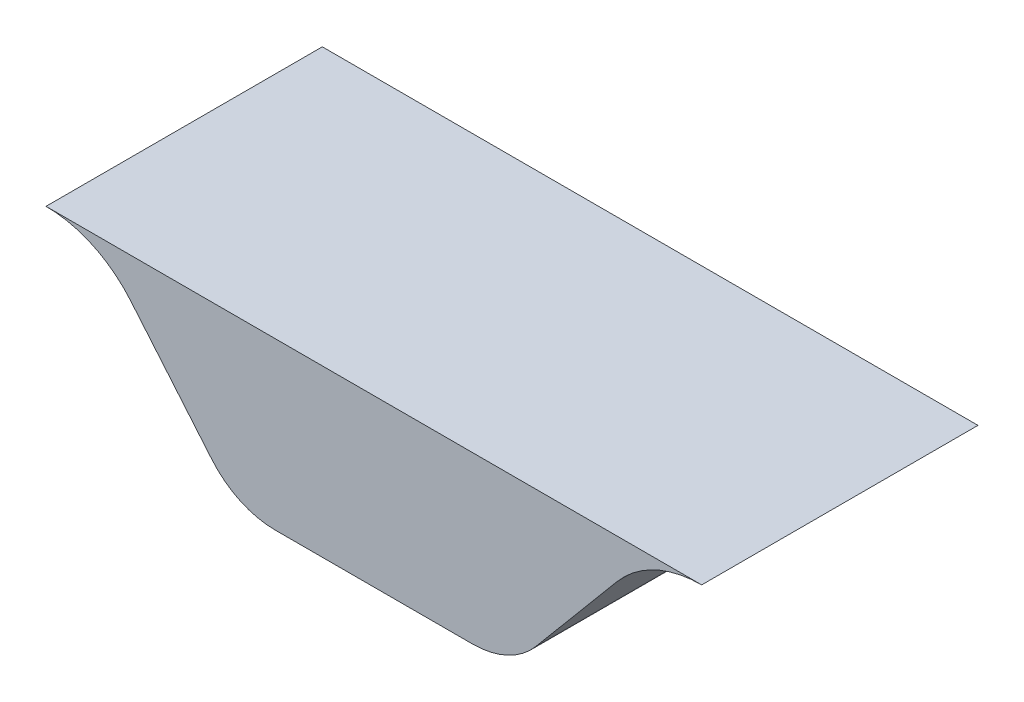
SolidWorks part; units mm, degrees
ref_plane "Plane1" through (0, 0, 0) normal (0, 0, 1) x (1, 0, 0)
ref_plane "Plane2" through (0, 0, 0) normal (0, 1, 0) x (1, 0, 0)
ref_plane "Plane3" through (0, 0, 0) normal (1, 0, 0) x (0, 0, -1)
sketch "Sketch1" plane through (0, 0, 0) normal (0, 0, 1) x (1, 0, 0)
  line L0 (-25, 5) -> (25, 5)
  line L1 (-25, 5) -> (-25, 0)
  line L2 (25, 0) -> (-25, 0)
  line L3 (25, 0) -> (25, 5)
  line L4 (0, 5) -> (0, 0) construction
  line L5 (50, 0) -> (-50, 0) construction
  dimension "D1" = 50
  dimension "D2" = 5
extrude "Base-Extrude" add sketch "Sketch1" along normal mid plane 50
sketch "Sketch2" plane through (0, 0, 0) normal (0, 0, 1) x (1, 0, 0)
  line L0 (0, 0) -> (0, -11.1464) construction
  line L1 (-10, 0) -> (-4.9654, -6)
  line L2 (25, 0) -> (-25, 0) construction
  line L3 (-4.9654, -6) -> (4.9654, -6)
  line L4 (-10, 0) -> (10, 0)
  line L5 (10, 0) -> (4.9654, -6)
  point P9 (0, 0)
  dimension "Width" = 20
  dimension "Inside Angle" = 50
  dimension "Height from Drop Face" = 6
extrude "Boss-Extrude1" add sketch "Sketch2" along normal mid plane 10
fillet "Fillet1" radius 3 2 edges at (4.9654, -6, 0) (-4.9654, -6, 0)
fillet "Fillet2" radius 4 2 edges at (10, 0, 0) (-10, 0, 0)
sketch "Sketch3" plane through (25, 0, 0) normal (1, 0, 0) x (0, 0, -1)
  line L4 (25, 5) -> (-25, 5)
  line L5 (-25, 5) -> (-25, 0)
  line L6 (-25, 0) -> (25, 0)
  line L7 (25, 0) -> (25, 5)
  line L8 (25, 5) -> (-25, 5)
  line L9 (-25, 5) -> (-25, 0)
  line L10 (-25, 0) -> (25, 0)
  line L11 (25, 0) -> (25, 5)
  dimension "D1" = 0
extrude "Cut-Extrude1" cut sketch "Sketch3" against normal through all
sketch "Orientation sketch" plane through (0, 0, 0) normal (0, 1, 0) x (-1, 0, 0)
  line L4 (-11.8652, 5) -> (-11.8652, -5)
  line L5 (-11.8652, 5) -> (-11.8652, -5)
  line L6 (-11.8652, -5) -> (11.8652, -5)
  line L7 (11.8652, -5) -> (11.8652, 5)
  line L8 (11.8652, 5) -> (-11.8652, 5)
  line L9 (11.8652, -5) -> (11.8652, 5)
  line L10 (-11.8652, -5) -> (11.8652, -5)
  line L12 (11.8652, 5) -> (-11.8652, 5)
  dimension "D1" = 0
